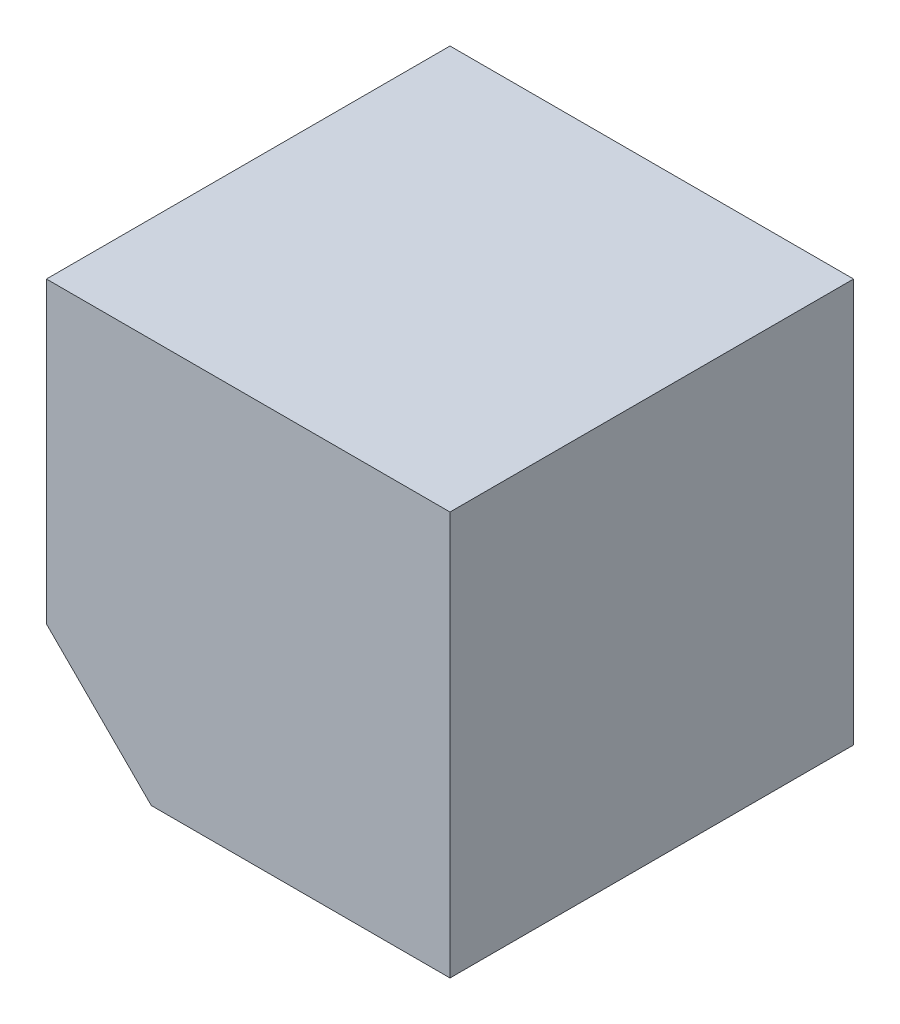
SolidWorks part; units mm, degrees
ref_plane "Ebene vorne" through (0, 0, 0) normal (0, 0, 1) x (1, 0, 0)
ref_plane "Ebene oben" through (0, 0, 0) normal (0, 1, 0) x (1, 0, 0)
ref_plane "Ebene rechts" through (0, 0, 0) normal (1, 0, 0) x (0, 0, -1)
sketch "Skizze1" plane through (0, 0, 0) normal (0, 0, 1) x (1, 0, 0)
  line L1 (0, 0) -> (100, 0)
  line L2 (0, 0) -> (0, 100)
  line L3 (0, 100) -> (100, 100)
  line L4 (100, 0) -> (100, 100)
  dimension "D1" = 100
extrude "Linear austragen1" add sketch "Skizze1" along normal blind 100
sketch3d "3D-Skizze1"
  line L0 (0, 0, 100) -> (100, 100, 0) construction
ref_plane "Ebene1" through (0, 0, 100) normal (0.5774, 0.5774, -0.5774) x (-0.8165, 0.4082, -0.4082)
ref_plane "Ebene2" through (-24.6731, -24.6731, 24.6731) normal (0.5774, 0.5774, -0.5774) x (-0.8165, 0.4082, -0.4082)
other "Oberflächenschnitt1"
equation "\"LÄNGE\"=0"
equation "\"BREITE\"=0"
equation "\"HÖHE\"=0"
equation "\"DURCHMESSER\"=0"
equation "\"Stückzahl\"= 1"
